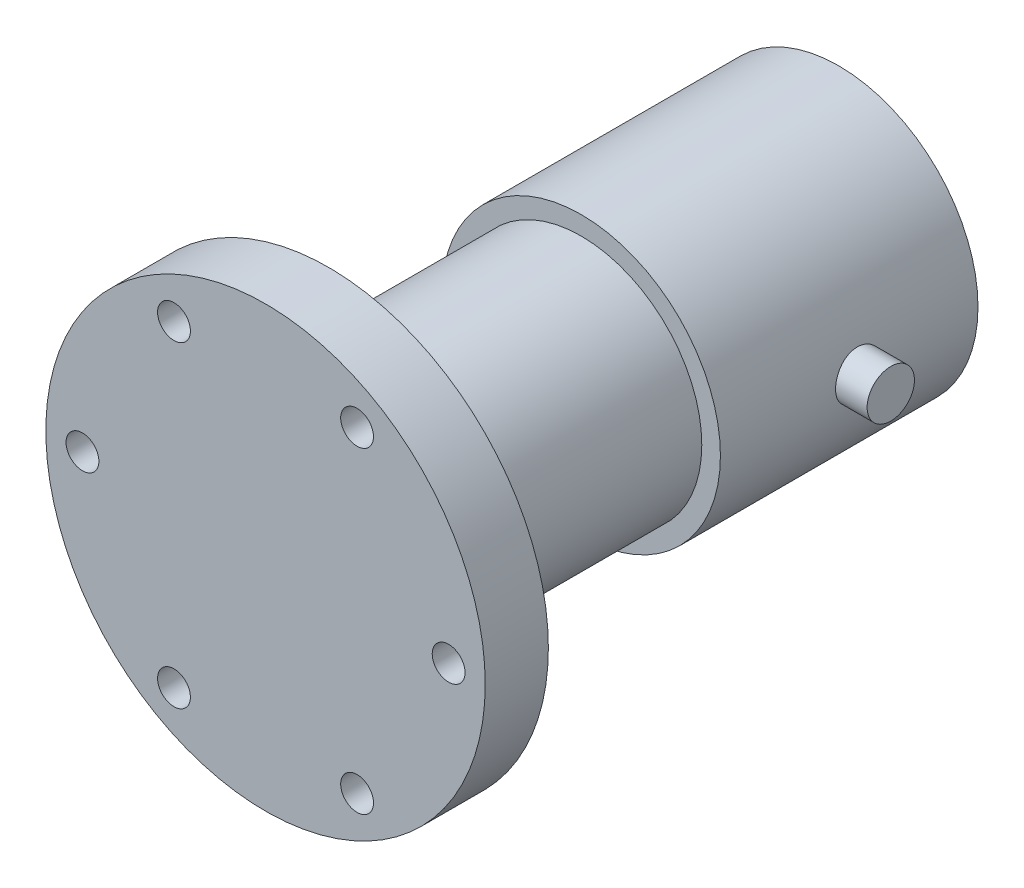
SolidWorks part; units mm, degrees
ref_plane "Front" through (0, 0, 0) normal (0, 0, 1) x (1, 0, 0)
ref_plane "Top" through (0, 0, 0) normal (0, 1, 0) x (1, 0, 0)
ref_plane "Right" through (0, 0, 0) normal (1, 0, 0) x (0, 0, -1)
mirrored part "1018690-SC-OCEAN DESIGN_Mirrored"
other "<1018690-SC-OCEAN DESIGN>-<CirPattern4>"
other "<1018690-SC-OCEAN DESIGN>-<Cut-Extrude2[1]>"
other "<1018690-SC-OCEAN DESIGN>-<Extrude4>"
